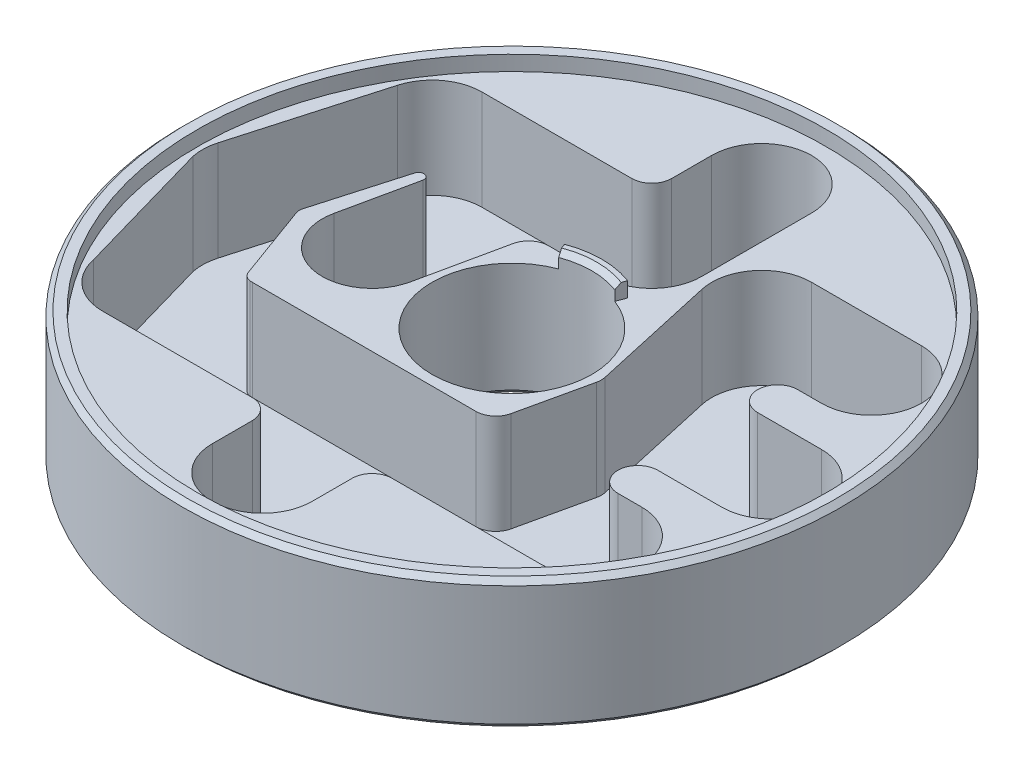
SolidWorks part; units mm, degrees
ref_plane "Front Plane" through (0, 0, 0) normal (0, 0, 1) x (1, 0, 0)
ref_plane "Top Plane" through (0, 0, 0) normal (0, 1, 0) x (1, 0, 0)
ref_plane "Right Plane" through (0, 0, 0) normal (1, 0, 0) x (0, 0, -1)
sketch "Sketch1" plane through (0, 0, 0) normal (0, 1, 0) x (1, 0, 0)
  circle A0 centre (0, 0) radius 8
  circle A1 centre (0, 0) radius 20 construction
  circle A2 centre (0, 0) radius 33
  circle A3 centre (0, 0) radius 14 construction
  circle A4 centre (0, 0) radius 26 construction
extrude "Boss-Extrude1" add sketch "Sketch1" against normal blind 13
sketch "Sketch2" plane through (0, 0, 0) normal (0, 1, 0) x (1, 0, 0)
  line L0 (0, 0) -> (0, 8) construction
  line L1 (0, 8) -> (3, 8) construction
  line L2 (3, 8) -> (2.809, 7.4906) construction
  line L3 (2.809, 7.4906) -> (3, 8)
  line L4 (3, 8) -> (3.1601, 8.427)
  line L5 (-2.809, 7.4906) -> (-3, 8)
  line L6 (-3, 8) -> (-3.1601, 8.427)
  arc A0 (-2.809, 7.4906) -> (2.809, 7.4906) centre (0, 0) ccw
  circle A1 centre (0, 0) radius 31.5
  arc A2 (3.1601, 8.427) -> (-3.1601, 8.427) centre (0, 0) ccw
extrude "Cut-Extrude1" cut sketch "Sketch2" against normal blind 1.5
chamfer "Chamfer1" distance 0.5 angle 45 4 edges at (0, 0, -8) (0, -13, 8) (0, -13, 33) (0, 0, 33)
sketch "Sketch4" plane through (0, -1.5, 0) normal (0, 1, 0) x (1, 0, 0)
  line L0 (0, 0) -> (33, 0) construction
  line L1 (0, -42.8166) -> (0, 42.8166) construction
  line L2 (5, 25) -> (5, 14)
  line L3 (-5, 25) -> (-5, 19)
  line L4 (-11, 19) -> (-5, 19)
  line L5 (-6.9579, 9) -> (0, 9)
  line L6 (-17.1849, 9) -> (-18.889, 1.0476)
  line L7 (-9.111, -1.0476) -> (-6.9579, 9)
  line L8 (-22, 19) -> (-11, 19)
  line L9 (-18.2316, 9) -> (-17.1849, 9)
  line L10 (-26.8076, 15.3736) -> (-30.8076, 1.3736)
  line L11 (-21.111, -1.0476) -> (-17.1935, 12.6226) construction
  line L12 (-21.111, -1.0476) -> (-18.2316, 9)
  line L13 (-18.4154, -9) -> (-11, -9)
  line L14 (-11, -9) -> (0, -9)
  line L15 (0, -9) -> (6.9924, -9)
  line L16 (-22, -19) -> (-5, -19)
  line L17 (5, -19) -> (11, -19)
  line L18 (-5, -25) -> (-5, -19)
  line L19 (5, -25) -> (5, -19)
  line L20 (-21.111, -1.0476) -> (-18.4154, -9)
  line L21 (-30.889, -1.0476) -> (-26.8993, -14.9984)
  line L22 (18.0076, 5) -> (26, 5)
  line L23 (18.0076, -5) -> (26, -5)
  line L24 (17.1153, 9) -> (22, 9)
  line L25 (11, 19) -> (22, 19)
  line L26 (9, 0) -> (6.1199, 12.9114)
  line L27 (17.1153, 9) -> (18.0076, 5)
  line L28 (17.1153, -9) -> (22, -9)
  line L29 (11, -19) -> (22, -19)
  line L30 (9, 0) -> (6.9924, -9)
  line L31 (17.1153, -9) -> (18.0076, -5)
  arc A0 (0, 9) -> (5, 14) centre (0, 14) ccw
  circle A1 centre (0, 0) radius 14 construction
  arc A2 (11, 19) -> (6.1199, 12.9114) centre (11, 14) ccw
  arc A3 (22, 9) -> (22, 19) centre (22, 14) ccw
  circle A4 centre (33, 14) radius 5 construction
  circle A5 centre (11, 25) radius 5 construction
  circle A6 centre (22, 25) radius 5 construction
  circle A7 centre (33, 25) radius 5 construction
  circle A8 centre (11, 36) radius 5 construction
  circle A9 centre (22, 36) radius 5 construction
  circle A10 centre (33, 36) radius 5 construction
  arc A11 (5, 25) -> (-5, 25) centre (0, 25) ccw
  circle A12 centre (0, 36) radius 5 construction
  circle A13 centre (0, 0) radius 33 construction
  circle A14 centre (-33, 36) radius 5 construction
  circle A15 centre (-22, 36) radius 5 construction
  circle A16 centre (-11, 36) radius 5 construction
  circle A17 centre (-33, 25) radius 5 construction
  circle A18 centre (-22, 25) radius 5 construction
  circle A19 centre (-11, 25) radius 5 construction
  circle A20 centre (-33, 14) radius 5 construction
  arc A21 (-26.8076, 15.3736) -> (-22, 19) centre (-22, 14) cw
  circle A22 centre (-11, 14) radius 5 construction
  circle A23 centre (-11, -14) radius 5 construction
  arc A24 (-26.8993, -14.9984) -> (-22, -19) centre (-22, -14) ccw
  circle A25 centre (-33, -14) radius 5 construction
  circle A26 centre (-11, -25) radius 5 construction
  circle A27 centre (-22, -25) radius 5 construction
  circle A28 centre (-33, -25) radius 5 construction
  circle A29 centre (-11, -36) radius 5 construction
  circle A30 centre (-22, -36) radius 5 construction
  circle A31 centre (-33, -36) radius 5 construction
  circle A32 centre (0, -36) radius 5 construction
  arc A33 (5, -25) -> (-5, -25) centre (0, -25) cw
  circle A34 centre (33, -36) radius 5 construction
  circle A35 centre (22, -36) radius 5 construction
  circle A36 centre (11, -36) radius 5 construction
  circle A37 centre (33, -25) radius 5 construction
  circle A38 centre (22, -25) radius 5 construction
  circle A39 centre (11, -25) radius 5 construction
  circle A40 centre (33, -14) radius 5 construction
  arc A41 (22, -9) -> (22, -19) centre (22, -14) cw
  circle A42 centre (11, -14) radius 5 construction
  circle A43 centre (0, -14) radius 5 construction
  arc A44 (-18.889, 1.0476) -> (-9.111, -1.0476) centre (-14, 0) ccw
  arc A45 (-30.8076, 1.3736) -> (-30.7037, -1.6957) centre (-26, 0) ccw
  circle A46 centre (0, 0) radius 26 construction
  circle A47 centre (14, 0) radius 5 construction
  arc A48 (26, -5) -> (26, 5) centre (26, 0) ccw
  dimension "D1" = 4
  dimension "D2" = 3
extrude "Cut-Extrude2" cut sketch "Sketch4" against normal blind 10 contours L23 A48 L22 L27 L24 A3 L25 A2 L26 L30 L15 L14 L13 L20 L12 L9 L6 A44 L7 L5 A0 L2 A11 L3 L4 L8 A21 L10 A45 L21 A24 L16 L18 A33 L19 L17 L29 A41 L28 L31
sketch "Sketch5" plane through (0, -11.5, 0) normal (0, 1, 0) x (1, 0, 0)
  circle A0 centre (26, 0) radius 5
  circle A1 centre (-14, 0) radius 5
extrude "Cut-Extrude3" cut sketch "Sketch5" against normal through all
fillet "Fillet1" radius 2 4 edges at (-5, -6.5, -19) (-18.4154, -6.5, 9) (9, -6.5, 0) (6.9924, -6.5, 9)
fillet "Fillet2" radius 2 1 edges at (-21.111, -6.5, 1.0476)
fillet "Fillet3" radius 2 6 edges at (5, -6.5, 19) (-5, -6.5, 19) (17.1153, -6.5, 9) (18.0076, -6.5, 5) (17.1153, -6.5, -9) (18.0076, -6.5, -5)
fillet "Fillet4" radius 0.5 2 edges at (-18.2316, -6.5, -9) (-17.1849, -6.5, -9)
fillet "Fillet5" radius 2 1 edges at (-6.9579, -6.5, -9)
sketch "Sketch6" plane through (0, -1.5, 0) normal (0, 1, 0) x (1, 0, 0)
  line L0 (-20.9388, -0.4467) -> (-17.6099, -9.5616)
  line L1 (-17.6099, -9.5616) -> (-22.7059, -11.4227)
  line L2 (-22.7059, -11.4227) -> (-26.5133, -0.9977)
  line L3 (-26.5133, -0.9977) -> (-20.9388, -0.4467)
extrude "Cut-Extrude4" cut sketch "Sketch6" against normal blind 10
fillet "Fillet6" radius 1 1 edges at (-20.9388, -6.5, 0.4467)
fillet "Fillet7" radius 1 1 edges at (-17.8957, -6.5, 8.7788)
